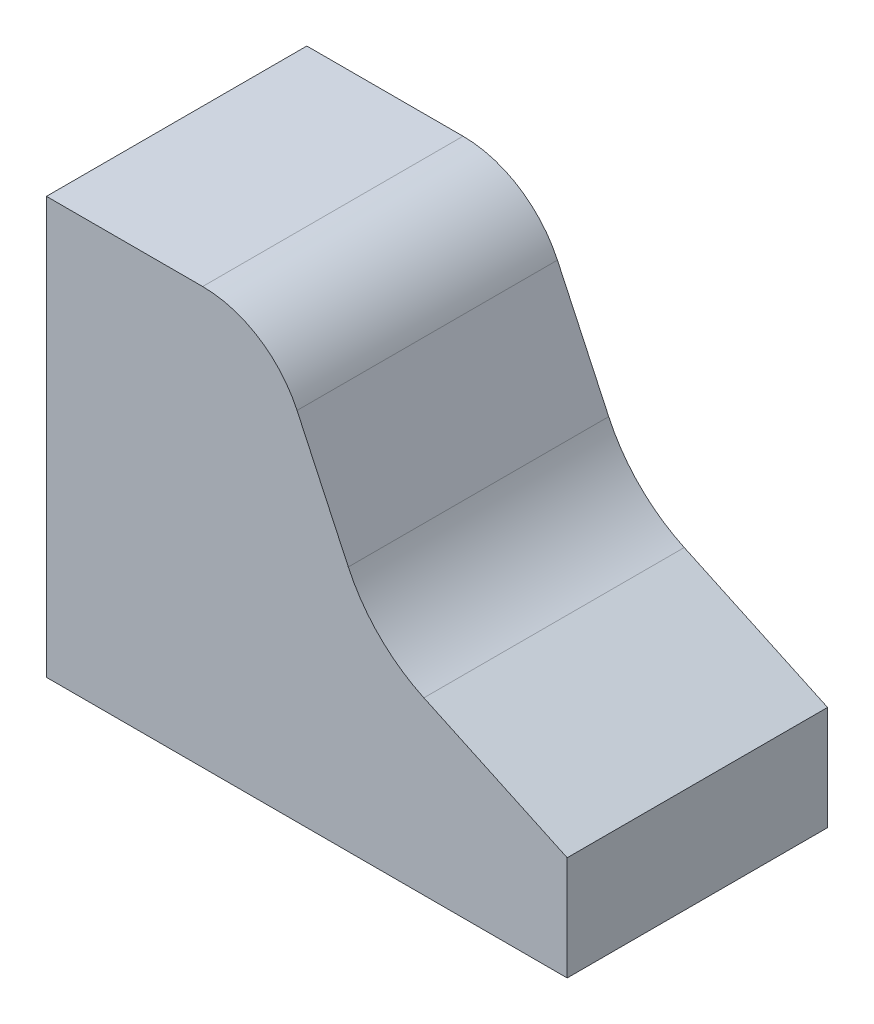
SolidWorks part; units mm, degrees
ref_plane "Front Plane" through (0, 0, 0) normal (0, 0, 1) x (1, 0, 0)
ref_plane "Top Plane" through (0, 0, 0) normal (0, 1, 0) x (1, 0, 0)
ref_plane "Right Plane" through (0, 0, 0) normal (1, 0, 0) x (0, 0, -1)
sketch "Sketch1" plane through (0, 0, 0) normal (0, 0, 1) x (1, 0, 0)
  line L0 (0, 0) -> (0, 101.6)
  line L1 (0, 0) -> (127, 0)
  line L2 (127, 0) -> (127, 25.4)
  line L3 (127, 25.4) -> (92.0497, 41.6976)
  line L4 (73.6212, 60.1261) -> (61.1202, 86.9345)
  line L5 (38.1, 101.6) -> (0, 101.6)
  arc A0 (92.0497, 41.6976) -> (73.6212, 60.1261) centre (108.1515, 76.2279) cw
  arc A1 (61.1202, 86.9345) -> (38.1, 101.6) centre (38.1, 76.2) ccw
  dimension "D3" = 38.1
  dimension "D4" = 25.4
  dimension "D1" = 127
  dimension "D2" = 101.6
  dimension "D5" = 25
  dimension "D6" = 25.4
  dimension "D7" = 38.1
  dimension "D8" = 25
extrude "Boss-Extrude1" add sketch "Sketch1" along normal blind 63.5
